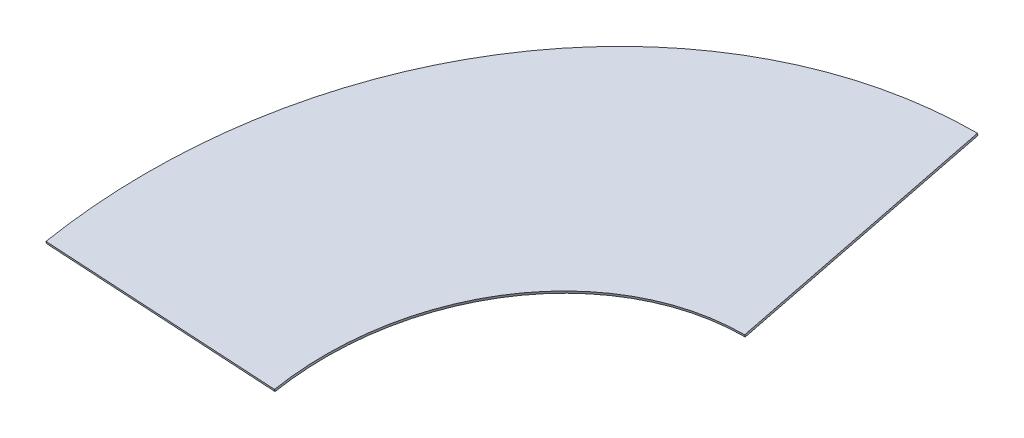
SolidWorks part; units mm, degrees
ref_plane "Ebene vorne" through (0, 0, 0) normal (0, 0, 1) x (1, 0, 0)
ref_plane "Ebene oben" through (0, 0, 0) normal (0, 1, 0) x (1, 0, 0)
ref_plane "Ebene rechts" through (0, 0, 0) normal (1, 0, 0) x (0, 0, -1)
sketch "Skizze1" plane through (0, 0, 0) normal (0, 0, 1) x (1, 0, 0)
  line L0 (0, 0) -> (0, 63.6385) construction
  line L1 (0, 0) -> (0.3349, 76.7522) construction
  arc A0 (0, 50) -> (0.2182, 49.9995) centre (0, 0) ccw
  dimension "D1" = 100
  dimension "D2" = 0.25
ref_plane "Ebene1" through (0, 0, 100) normal (0, 0, 1) x (1, 0, 0)
sketch "Skizze2" plane through (0, 0, 100) normal (0, 0, 1) x (1, 0, 0)
  line L1 (0, 0) -> (0, 31.8193) construction
  line L2 (0, 0) -> (0, 63.6385) construction
  line L3 (0, 0) -> (0.1575, 36.0899) construction
  arc A0 (0, 25) -> (0.1091, 24.9998) centre (0, 0) ccw
  dimension "D1" = 50
  dimension "D2" = 0.25
sketch "Skizze3" plane through (0, 0, 0) normal (1, 0, 0) x (0, 0, -1)
  line L0 (0, 0) -> (-100, 0)
sheet metal parameters "Blech1" thickness 1 parameters "D1"=25, "Dicke"=1
lofted bend "Ausgeformte Biegungen1" parameters "D1"=0, "D12"=1
other "Freiform-Biegung1" parameters "D1"=1000, "D4"=0.25, "D5"=1
flat pattern "Abwicklung1"
sketch "Biegung-Linien3" plane through (0, 47.0588, 11.7647) normal (0, -0.9701, -0.2425) x (1, 0, 0)
  line L0 (-104.9568, 190.9911) -> (-207.9159, 186.0496) construction
  line L1 (-104.8268, 188.7722) -> (-207.6584, 181.6545) construction
  line L2 (-104.6499, 186.5567) -> (-207.308, 177.266) construction
  line L3 (-104.4261, 184.3455) -> (-206.8648, 172.8858) construction
  line L4 (-104.1557, 182.1395) -> (-206.3291, 168.516) construction
  line L5 (-103.8386, 179.9398) -> (-205.7011, 164.1586) construction
  line L6 (-103.4752, 177.7473) -> (-204.981, 159.8153) construction
  line L7 (-103.0654, 175.5629) -> (-204.1693, 155.4883) construction
  line L8 (-102.6095, 173.3878) -> (-203.2663, 151.1794) construction
  line L9 (-102.1077, 171.2227) -> (-202.2723, 146.8906) construction
  line L10 (-101.5603, 169.0688) -> (-201.1879, 142.6237) construction
  line L11 (-100.9674, 166.927) -> (-200.0134, 138.3808) construction
  line L12 (-100.3293, 164.7982) -> (-198.7495, 134.1636) construction
  line L13 (-99.6464, 162.6834) -> (-197.3966, 129.9741) construction
  line L14 (-98.919, 160.5836) -> (-195.9555, 125.8141) construction
  line L15 (-98.1473, 158.4996) -> (-194.4267, 121.6856) construction
  line L16 (-97.3317, 156.4324) -> (-192.811, 117.5903) construction
  line L17 (-96.4726, 154.3829) -> (-191.1089, 113.5301) construction
  line L18 (-95.5702, 152.352) -> (-189.3215, 109.5068) construction
  line L19 (-94.6252, 150.3406) -> (-187.4493, 105.5222) construction
  line L20 (-93.6378, 148.3496) -> (-185.4932, 101.5781) construction
  line L21 (-92.6085, 146.38) -> (-183.4542, 97.6762) construction
  line L22 (-91.5378, 144.4326) -> (-181.3331, 93.8183) construction
  line L23 (-90.4262, 142.5082) -> (-179.1309, 90.0062) construction
  line L24 (-89.274, 140.6078) -> (-176.8486, 86.2415) construction
  line L25 (-88.0819, 138.7321) -> (-174.4872, 82.5259) construction
  line L26 (-86.8504, 136.882) -> (-172.0477, 78.861) construction
  line L27 (-85.5801, 135.0583) -> (-169.5312, 75.2486) construction
  line L28 (-84.2714, 133.2619) -> (-166.939, 71.6902) construction
  line L29 (-82.9251, 131.4937) -> (-164.272, 68.1875) construction
  line L30 (-81.5416, 129.7543) -> (-161.5315, 64.7419) construction
  line L31 (-80.1218, 128.0446) -> (-158.7188, 61.355) construction
  line L32 (-78.6661, 126.3653) -> (-155.8351, 58.0284) construction
  line L33 (-77.1752, 124.7172) -> (-152.8817, 54.7635) construction
  line L34 (-75.6498, 123.101) -> (-149.8599, 51.5618) construction
  line L35 (-74.0906, 121.5175) -> (-146.7711, 48.4247) construction
  line L36 (-72.4982, 119.9672) -> (-143.6166, 45.3537) construction
  line L37 (-70.8734, 118.451) -> (-140.3979, 42.3501) construction
  line L38 (-69.217, 116.9695) -> (-137.1163, 39.4152) construction
  line L39 (-67.5295, 115.5234) -> (-133.7734, 36.5503) construction
  line L40 (-65.8119, 114.1132) -> (-130.3707, 33.7568) construction
  line L41 (-64.0647, 112.7397) -> (-126.9097, 31.0359) construction
  line L42 (-62.2889, 111.4034) -> (-123.3919, 28.3888) construction
  line L43 (-60.4852, 110.105) -> (-119.8189, 25.8167) construction
  line L44 (-58.6544, 108.845) -> (-116.1923, 23.3207) construction
  line L45 (-56.7974, 107.6239) -> (-112.5137, 20.902) construction
  line L46 (-54.9149, 106.4424) -> (-108.7848, 18.5616) construction
  line L47 (-53.0079, 105.3011) -> (-105.0072, 16.3006) construction
  line L48 (-51.0772, 104.2003) -> (-101.1827, 14.1201) construction
  line L49 (-49.1237, 103.1406) -> (-97.3129, 12.0208) construction
  line L50 (-47.1483, 102.1224) -> (-93.3995, 10.0039) construction
  line L51 (-45.1518, 101.1463) -> (-89.4444, 8.0702) construction
  line L52 (-43.1351, 100.2127) -> (-85.4493, 6.2206) construction
  line L53 (-41.0991, 99.3218) -> (-81.4159, 4.4559) construction
  line L54 (-39.0447, 98.4743) -> (-77.3462, 2.7769) construction
  line L55 (-36.9728, 97.6704) -> (-73.2418, 1.1843) construction
  line L56 (-34.8845, 96.9105) -> (-69.1047, -0.3211) construction
  line L57 (-32.7806, 96.1949) -> (-64.9367, -1.7387) construction
  line L58 (-30.662, 95.524) -> (-60.7396, -3.0678) construction
  line L59 (-28.5297, 94.8981) -> (-56.5153, -4.3078) construction
  line L60 (-26.3846, 94.3173) -> (-52.2657, -5.4583) construction
  line L61 (-24.2277, 93.7821) -> (-47.9928, -6.5186) construction
  line L62 (-22.0599, 93.2926) -> (-43.6984, -7.4883) construction
  line L63 (-19.8822, 92.849) -> (-39.3845, -8.3669) construction
  line L64 (-17.6956, 92.4516) -> (-35.0529, -9.1541) construction
  line L65 (-15.5011, 92.1005) -> (-30.7057, -9.8496) construction
  line L66 (-13.2996, 91.7959) -> (-26.3448, -10.4529) construction
  line L67 (-11.0922, 91.538) -> (-21.972, -10.9639) construction
  line L68 (-8.8798, 91.3267) -> (-17.5894, -11.3823) construction
  line L69 (-6.6634, 91.1624) -> (-13.199, -11.7079) construction
  line L70 (-4.444, 91.0449) -> (-8.8026, -11.9406) construction
  line L71 (-2.2226, 90.9744) -> (-4.4023, -12.0802) construction
  line L72 (0, 90.9509) -> (0, -12.1268) construction
other "Abwickeln-<Freiform-Biegung1>1"
